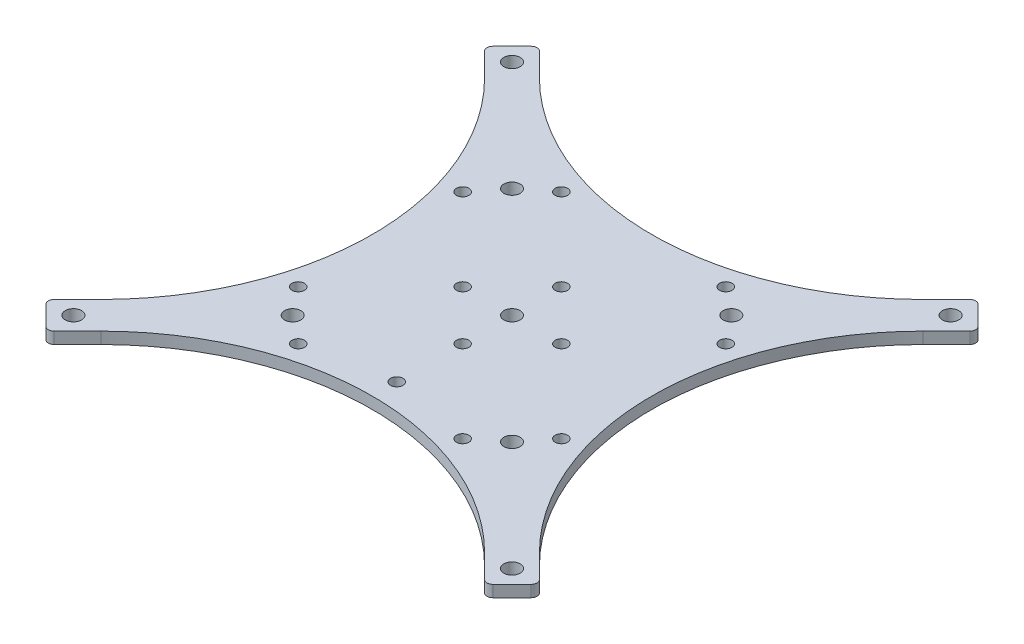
SolidWorks part; units mm, degrees
ref_plane "前视基准面" through (0, 0, 0) normal (0, 0, 1) x (1, 0, 0)
ref_plane "上视基准面" through (0, 0, 0) normal (0, 1, 0) x (1, 0, 0)
ref_plane "右视基准面" through (0, 0, 0) normal (1, 0, 0) x (0, 0, -1)
other "Configuration Table"
sketch "草图1" plane through (0, 0, 0) normal (0, 1, 0) x (1, 0, 0)
  line L0 (-215.6676, 208.5965) -> (-208.5965, 215.6676) construction
  line L1 (-215.6676, 208.5965) -> (208.5965, -215.6676) construction
  line L2 (-208.5965, 215.6676) -> (215.6676, -208.5965) construction
  line L3 (208.5965, -215.6676) -> (215.6676, -208.5965) construction
  line L4 (-215.6676, 208.5965) -> (215.6676, -208.5965) construction
  line L5 (-208.5965, 215.6676) -> (208.5965, -215.6676) construction
  line L6 (-208.5965, -215.6676) -> (-215.6676, -208.5965) construction
  line L7 (-208.5965, -215.6676) -> (215.6676, 208.5965) construction
  line L8 (-215.6676, -208.5965) -> (208.5965, 215.6676) construction
  line L9 (215.6676, 208.5965) -> (208.5965, 215.6676) construction
  line L10 (-208.5965, -215.6676) -> (208.5965, 215.6676) construction
  line L11 (-215.6676, -208.5965) -> (215.6676, 208.5965) construction
  line L12 (0, 0) -> (0, 123.476) construction
  line L13 (0, 0) -> (28.2843, -28.2843) construction
  line L14 (0, 0) -> (28.2843, -28.2843) construction
  line L15 (0, 0) -> (-28.2843, -28.2843) construction
  line L16 (-49.4975, -56.5685) -> (-56.5685, -63.6396)
  line L17 (-56.5685, -63.6396) -> (-63.6396, -56.5685)
  line L18 (-63.6396, -56.5685) -> (-56.5686, -49.4975)
  line L19 (-63.6396, 56.5685) -> (-56.5685, 63.6396)
  line L20 (-56.5685, 63.6396) -> (-49.4975, 56.5686)
  line L21 (-56.5685, 49.4975) -> (-63.6396, 56.5685)
  line L22 (56.5685, 63.6396) -> (63.6396, 56.5685)
  line L23 (63.6396, 56.5685) -> (56.5686, 49.4975)
  line L24 (49.4975, 56.5685) -> (56.5685, 63.6396)
  line L25 (63.6396, -56.5685) -> (56.5685, -63.6396)
  line L26 (56.5685, -63.6396) -> (49.4975, -56.5686)
  line L27 (56.5685, -49.4975) -> (63.6396, -56.5685)
  line L28 (0, 0) -> (-56.5686, -49.4975) construction
  circle A0 centre (0, 0) radius 2.1
  circle A1 centre (28.2843, -28.2843) radius 2.1
  circle A2 centre (56.5685, -56.5685) radius 2.1
  circle A3 centre (-28.2843, -28.2843) radius 2.1
  circle A4 centre (-56.5685, -56.5685) radius 2.1
  circle A5 centre (-28.2843, 28.2843) radius 2.1
  circle A6 centre (-56.5685, 56.5685) radius 2.1
  circle A7 centre (28.2843, 28.2843) radius 2.1
  circle A8 centre (56.5685, 56.5685) radius 2.1
  arc A9 (-49.4975, -56.5685) -> (49.4975, -56.5686) centre (0, -106.066) cw
  arc A10 (-56.5685, 49.4975) -> (-56.5686, -49.4975) centre (-106.066, 0) cw
  arc A11 (49.4975, 56.5685) -> (-49.4975, 56.5686) centre (0, 106.066) cw
  arc A12 (56.5685, -49.4975) -> (56.5686, 49.4975) centre (106.066, 0) cw
  circle A13 centre (-21.2132, -33.9411) radius 1.6
  circle A14 centre (21.2132, -33.9411) radius 1.6
  circle A15 centre (0, -12.7279) radius 1.6
  circle A16 centre (0, -29.7279) radius 1.6
  circle A17 centre (-33.9411, 21.2132) radius 1.6
  circle A18 centre (-12.7279, 0) radius 1.6
  circle A19 centre (-33.9411, -21.2132) radius 1.6
  circle A20 centre (21.2132, 33.9411) radius 1.6
  circle A21 centre (0, 12.7279) radius 1.6
  circle A22 centre (-21.2132, 33.9411) radius 1.6
  circle A23 centre (33.9411, -21.2132) radius 1.6
  circle A24 centre (12.7279, 0) radius 1.6
  circle A25 centre (33.9411, 21.2132) radius 1.6
  point P1 (0, 0)
  point P2 (0, 0)
  point P85 (0, 0)
  dimension "D8" = 4.2
  dimension "D12" = 70
  dimension "D15" = 3.2
  dimension "D1" = 45
  dimension "D2" = 10
  dimension "D3" = 10
  dimension "D4" = 600
  dimension "D5" = 600
  dimension "D7" = 40
  dimension "D10" = 90
  dimension "D11" = 40
  dimension "D13" = 5
  dimension "D16" = 4
  dimension "D17" = 4
  dimension "D18" = 4
  dimension "D19" = 30
  dimension "D20" = 30
  dimension "D21" = 17
  dimension "D6" = 3
  dimension "D9" = 4
  dimension "D14" = 4
  dimension "D22" = 4
extrude "凸台-拉伸1" add sketch "草图1" along normal blind 3
fillet "圆角1" radius 1.5 8 edges at (-63.6396, 1.5, -56.5685) (-56.5685, 1.5, -63.6396) (56.5685, 1.5, -63.6396) (63.6396, 1.5, -56.5685) (63.6396, 1.5, 56.5685) (56.5685, 1.5, 63.6396) (-63.6396, 1.5, 56.5685) (-56.5685, 1.5, 63.6396)
